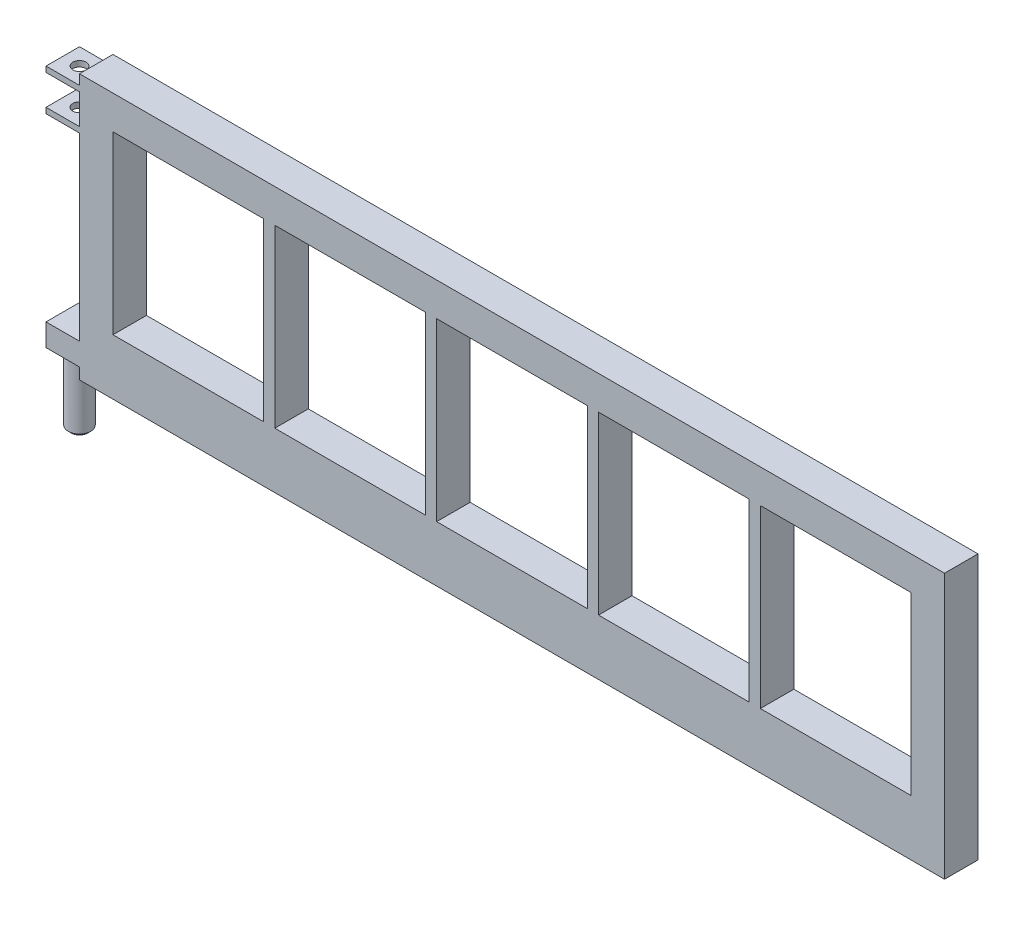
SolidWorks part; units mm, degrees
ref_plane "Plan1" through (0, 0, 0) normal (0, 0, 1) x (1, 0, 0)
ref_plane "Plan2" through (0, 0, 0) normal (0, 1, 0) x (1, 0, 0)
ref_plane "Plan3" through (0, 0, 0) normal (1, 0, 0) x (0, 0, -1)
sketch "Esquisse1" plane through (0, 0, 0) normal (0, 0, 1) x (1, 0, 0)
  line L1 (-100, 167.5) -> (675, 167.5)
  line L2 (-100, 167.5) -> (-100, -70)
  line L3 (-100, -70) -> (675, -70)
  line L4 (675, 167.5) -> (675, -70)
  line L5 (-70, 137.5) -> (645, 137.5)
  line L6 (-70, 137.5) -> (-70, -20)
  line L7 (-70, -20) -> (645, -20)
  line L8 (645, 137.5) -> (645, -20)
  dimension "D1" = 775
  dimension "D2" = 237.5
  dimension "D3" = 50
  dimension "D4" = 30
  dimension "D5" = 30
  dimension "D6" = 30
extrude "Base-Extrusion" add sketch "Esquisse1" along normal blind 30
sketch "Esquisse2" plane through (-100, 0, 0) normal (-1, 0, 0) x (0, 0, 1)
  line L0 (30, 167.5) -> (30, -70) construction
  line L1 (30, 158.5) -> (0, 158.5)
  line L2 (30, 158.5) -> (30, 153.5)
  line L3 (30, 153.5) -> (0, 153.5)
  line L4 (0, 158.5) -> (0, 153.5)
  line L5 (0, 167.5) -> (0, -70) construction
  line L6 (30, 126.5) -> (0, 126.5)
  line L7 (30, 126.5) -> (30, 121.5)
  line L8 (30, 121.5) -> (0, 121.5)
  line L9 (0, 126.5) -> (0, 121.5)
  dimension "D1" = 5
  dimension "D2" = 5
  dimension "D3" = 27
  dimension "D4" = 9
extrude "Boss.-Extru.1" add sketch "Esquisse2" along normal blind 30
sketch "Esquisse3" plane through (0, 158.5, 0) normal (0, 1, 0) x (-1, 0, 0)
  circle A0 centre (115, 15) radius 6
  dimension "D3" = 12
  dimension "D1" = 15
  dimension "D2" = 15
extrude "Enlèv. mat.-Extru.1" cut sketch "Esquisse3" against normal through all
sketch "Esquisse4" plane through (0, -20, 0) normal (0, 1, 0) x (-1, 0, 0)
  line L0 (-675, 30) -> (100, 30) construction
  line L1 (-510, 30) -> (-500, 30)
  line L2 (-510, 30) -> (-510, 0)
  line L3 (-510, 0) -> (-500, 0)
  line L4 (-500, 30) -> (-500, 0)
  line L5 (-675, 0) -> (100, 0) construction
  dimension "D1" = 10
  dimension "D2" = 135
extrude "Boss.-Extru.2" add sketch "Esquisse4" along normal up to next
pattern_linear "Répétition linéaire1" count 4 spacing 145 along (-1, 0, 0) of "Boss.-Extru.2"
sketch "Esquisse5" plane through (-100, 0, 0) normal (-1, 0, 0) x (0, 0, 1)
  line L0 (30, 121.5) -> (30, -70) construction
  line L1 (30, -60) -> (0, -60)
  line L2 (30, -60) -> (30, -40)
  line L3 (30, -40) -> (0, -40)
  line L4 (0, -60) -> (0, -40)
  line L5 (0, 121.5) -> (0, -70) construction
  dimension "D1" = 20
  dimension "D2" = 10
extrude "Boss.-Extru.3" add sketch "Esquisse5" along normal blind 30
sketch "Esquisse6" plane through (0, -60, 0) normal (0, -1, 0) x (1, 0, 0)
  circle A0 centre (-115, 15) radius 10
  circle A1 centre (-115, 15) radius 6 construction
  dimension "D1" = 20
extrude "Boss.-Extru.4" add sketch "Esquisse6" along normal blind 62.5
chamfer "Chanfrein1" distance 2.5 angle 45 1 edges at (-105, -122.5, 15)
sketch "Esquisse7" plane through (0, 0, 0) normal (0, 0, -1) x (-1, 0, 0)
  line L1 (-675, 167.5) -> (-646.098, 167.5)
  line L2 (-675, 167.5) -> (-675, -50.1663)
  line L3 (-675, -50.1663) -> (-646.098, -50.1663)
  line L4 (-646.098, 167.5) -> (-646.098, -50.1663)
extrude "Extrusion1" add sketch "Esquisse7" along normal blind 0.01
